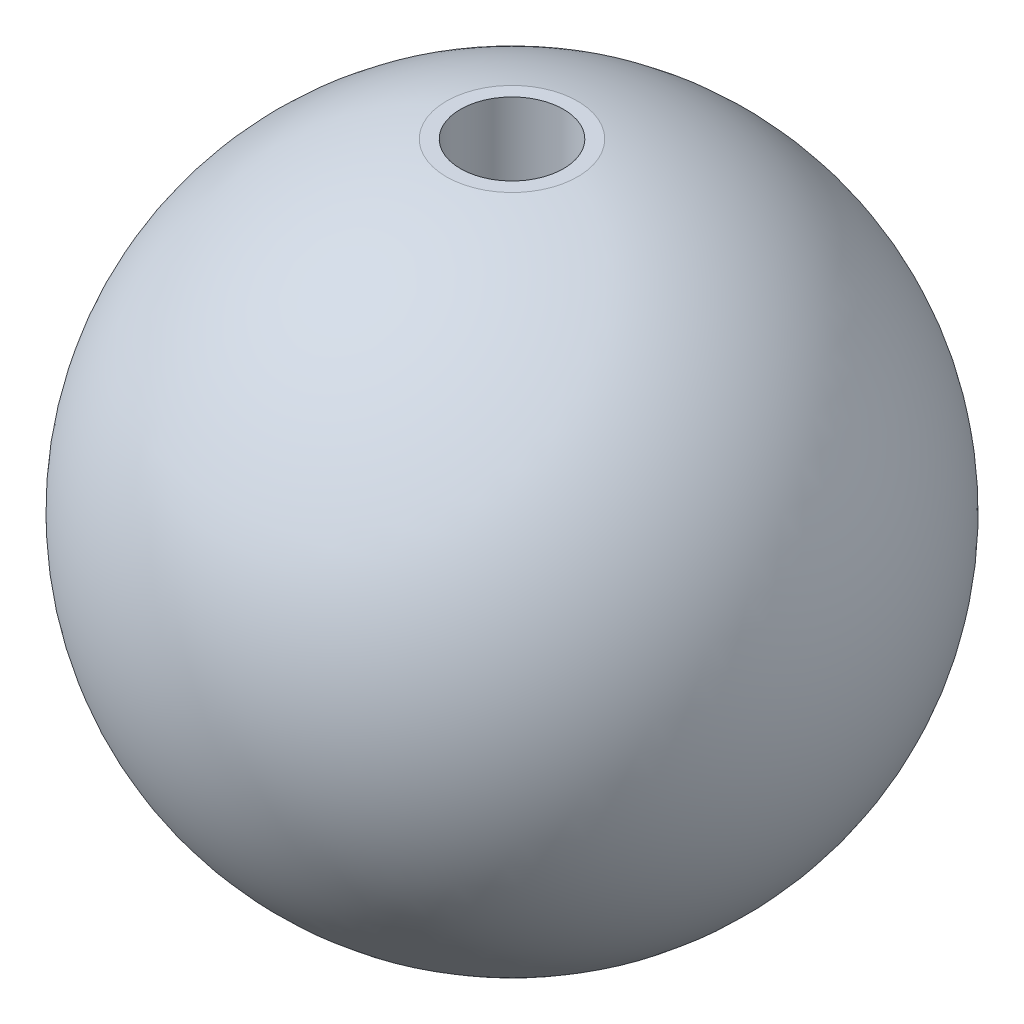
SolidWorks part; units mm, degrees
ref_plane "Front Plane" through (0, 0, 0) normal (0, 0, 1) x (1, 0, 0)
ref_plane "Top Plane" through (0, 0, 0) normal (0, 1, 0) x (1, 0, 0)
ref_plane "Right Plane" through (0, 0, 0) normal (1, 0, 0) x (0, 0, -1)
sketch "Sketch3" plane through (0, 0, 0) normal (0, 0, 1) x (1, 0, 0)
  line L0 (0, -25.4) -> (0, 25.4)
  arc A0 (0, -25.4) -> (0, 25.4) centre (0, 0) ccw
  dimension "D1" = 50.8
revolve "Revolve1" add sketch "Sketch3" angle 360 about L0
ref_plane "Plane1" through (0, 25.4, 0) normal (0, 1, 0) x (-1, 0, 0)
sketch "Sketch5" plane through (0, 25.4, 0) normal (0, 1, 0) x (-1, 0, 0)
  point P0 (0, 0)
sketch "Sketch7" plane through (0, 25.4, 0) normal (0, 1, 0) x (-1, 0, 0)
  circle A0 centre (0, 0) radius 6.35
  dimension "D1" = 12.7
extrude "Cut-Extrude1" cut sketch "Sketch7" against normal blind 0.508
hole_wizard "3/8-16 Tapped Hole1" positions "3DSketch2" profile "Sketch10" tap size "3/8-16" standard "Ansi Inch"
sketch3d "3DSketch2"
  point P11 (0, 24.892, 0)
sketch "Sketch10" plane through (0, 24.892, 0) normal (1, 0, 0) x (0, 0, 1)
  line L0 (0, 0) -> (0, 29.3087)
  line L1 (0, 29.3087) -> (3.9687, 26.924)
  line L2 (3.9687, 26.924) -> (3.9687, 0)
  line L5 (3.9687, 0) -> (0, 0)
  line L10 (0, 29.3087) -> (-3.9688, 26.924) construction
  line L11 (0, -6.35) -> (0, 107.95) construction
  dimension "Tap Drill Dia." = 7.9375
  dimension "Tap Drill Depth" = 26.924
  dimension "Drill Angle" = 118
